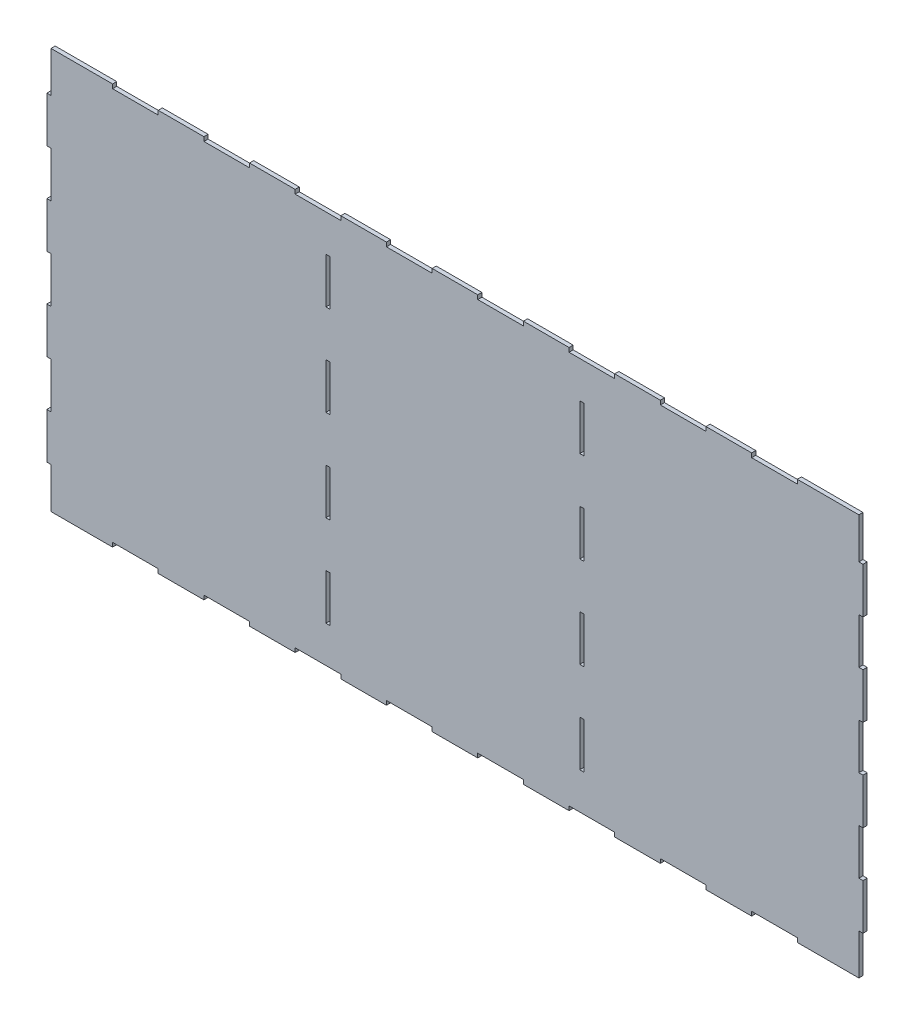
SolidWorks part; units mm, degrees
ref_plane "Front Plane" through (0, 0, 0) normal (0, 0, 1) x (1, 0, 0)
ref_plane "Top Plane" through (0, 0, 0) normal (0, 1, 0) x (1, 0, 0)
ref_plane "Right Plane" through (0, 0, 0) normal (1, 0, 0) x (0, 0, -1)
sketch "Sketch1" plane through (0, 0, 0) normal (0, 0, 1) x (1, 0, 0)
  line L0 (296, 586) -> (296, 556.5)
  line L1 (296, 556.5) -> (293, 556.5)
  line L2 (293, 556.5) -> (293, 523.5)
  line L3 (293, 523.5) -> (296, 523.5)
  line L4 (296, 523.5) -> (296, 490.5)
  line L5 (296, 490.5) -> (293, 490.5)
  line L6 (293, 490.5) -> (293, 457.5)
  line L7 (293, 457.5) -> (296, 457.5)
  line L8 (296, 457.5) -> (296, 424.5)
  line L9 (296, 424.5) -> (293, 424.5)
  line L10 (293, 424.5) -> (293, 391.5)
  line L11 (293, 391.5) -> (296, 391.5)
  line L12 (296, 391.5) -> (296, 358.5)
  line L13 (296, 358.5) -> (293, 358.5)
  line L14 (293, 358.5) -> (293, 325.5)
  line L15 (293, 325.5) -> (296, 325.5)
  line L16 (296, 325.5) -> (296, 296)
  line L17 (296, 296) -> (340.5, 296)
  line L18 (340.5, 296) -> (340.5, 299)
  line L19 (340.5, 299) -> (373.5, 299)
  line L20 (373.5, 299) -> (373.5, 296)
  line L21 (373.5, 296) -> (406.5, 296)
  line L22 (406.5, 296) -> (406.5, 299)
  line L23 (406.5, 299) -> (439.5, 299)
  line L24 (439.5, 299) -> (439.5, 296)
  line L25 (439.5, 296) -> (472.5, 296)
  line L26 (472.5, 296) -> (472.5, 299)
  line L27 (472.5, 299) -> (505.5, 299)
  line L28 (505.5, 299) -> (505.5, 296)
  line L29 (505.5, 296) -> (538.5, 296)
  line L30 (538.5, 296) -> (538.5, 299)
  line L31 (538.5, 299) -> (571.5, 299)
  line L32 (571.5, 299) -> (571.5, 296)
  line L33 (571.5, 296) -> (604.5, 296)
  line L34 (604.5, 296) -> (604.5, 299)
  line L35 (604.5, 299) -> (637.5, 299)
  line L36 (637.5, 299) -> (637.5, 296)
  line L37 (637.5, 296) -> (670.5, 296)
  line L38 (670.5, 296) -> (670.5, 299)
  line L39 (670.5, 299) -> (703.5, 299)
  line L40 (703.5, 299) -> (703.5, 296)
  line L41 (703.5, 296) -> (736.5, 296)
  line L42 (736.5, 296) -> (736.5, 299)
  line L43 (736.5, 299) -> (769.5, 299)
  line L44 (769.5, 299) -> (769.5, 296)
  line L45 (769.5, 296) -> (802.5, 296)
  line L46 (802.5, 296) -> (802.5, 299)
  line L47 (802.5, 299) -> (835.5, 299)
  line L48 (835.5, 299) -> (835.5, 296)
  line L49 (835.5, 296) -> (868.5, 296)
  line L50 (868.5, 296) -> (880, 296)
  line L51 (880, 296) -> (880, 325.5)
  line L52 (880, 325.5) -> (883, 325.5)
  line L53 (883, 325.5) -> (883, 358.5)
  line L54 (883, 358.5) -> (880, 358.5)
  line L55 (880, 358.5) -> (880, 391.5)
  line L56 (880, 391.5) -> (883, 391.5)
  line L57 (883, 391.5) -> (883, 424.5)
  line L58 (883, 424.5) -> (880, 424.5)
  line L59 (880, 424.5) -> (880, 457.5)
  line L60 (880, 457.5) -> (883, 457.5)
  line L61 (883, 457.5) -> (883, 490.5)
  line L62 (883, 490.5) -> (880, 490.5)
  line L63 (880, 490.5) -> (880, 523.5)
  line L64 (880, 523.5) -> (883, 523.5)
  line L65 (883, 523.5) -> (883, 556.5)
  line L66 (883, 556.5) -> (880, 556.5)
  line L67 (880, 556.5) -> (880, 586)
  line L68 (880, 586) -> (835.5, 586)
  line L69 (835.5, 586) -> (835.5, 583)
  line L70 (835.5, 583) -> (802.5, 583)
  line L71 (802.5, 583) -> (802.5, 586)
  line L72 (802.5, 586) -> (769.5, 586)
  line L73 (769.5, 586) -> (769.5, 583)
  line L74 (769.5, 583) -> (736.5, 583)
  line L75 (736.5, 583) -> (736.5, 586)
  line L76 (736.5, 586) -> (703.5, 586)
  line L77 (703.5, 586) -> (703.5, 583)
  line L78 (703.5, 583) -> (670.5, 583)
  line L79 (670.5, 583) -> (670.5, 586)
  line L80 (670.5, 586) -> (637.5, 586)
  line L81 (637.5, 586) -> (637.5, 583)
  line L82 (637.5, 583) -> (604.5, 583)
  line L83 (604.5, 583) -> (604.5, 586)
  line L84 (604.5, 586) -> (571.5, 586)
  line L85 (571.5, 586) -> (571.5, 583)
  line L86 (571.5, 583) -> (538.5, 583)
  line L87 (538.5, 583) -> (538.5, 586)
  line L88 (538.5, 586) -> (505.5, 586)
  line L89 (505.5, 586) -> (505.5, 583)
  line L90 (505.5, 583) -> (472.5, 583)
  line L91 (472.5, 583) -> (472.5, 586)
  line L92 (472.5, 586) -> (439.5, 586)
  line L93 (439.5, 586) -> (439.5, 583)
  line L94 (439.5, 583) -> (406.5, 583)
  line L95 (406.5, 583) -> (406.5, 586)
  line L96 (406.5, 586) -> (373.5, 586)
  line L97 (373.5, 586) -> (373.5, 583)
  line L98 (373.5, 583) -> (340.5, 583)
  line L99 (340.5, 583) -> (340.5, 586)
  line L100 (340.5, 586) -> (307.5, 586)
  line L101 (307.5, 586) -> (296, 586)
  line L102 (494.75, 556.5) -> (497.75, 556.5)
  line L107 (678.25, 556.5) -> (681.25, 556.5)
  line L108 (678.25, 556.5) -> (678.25, 523.5)
  line L109 (678.25, 523.5) -> (681.25, 523.5)
  line L110 (681.25, 556.5) -> (681.25, 523.5)
  line L111 (678.25, 490.5) -> (681.25, 490.5)
  line L112 (678.25, 490.5) -> (678.25, 457.5)
  line L113 (678.25, 457.5) -> (681.25, 457.5)
  line L114 (681.25, 490.5) -> (681.25, 457.5)
  line L115 (678.25, 424.5) -> (681.25, 424.5)
  line L116 (678.25, 424.5) -> (678.25, 391.5)
  line L117 (678.25, 391.5) -> (681.25, 391.5)
  line L118 (681.25, 424.5) -> (681.25, 391.5)
  line L119 (678.25, 358.5) -> (681.25, 358.5)
  line L120 (678.25, 358.5) -> (678.25, 325.5)
  line L121 (678.25, 325.5) -> (681.25, 325.5)
  line L122 (681.25, 358.5) -> (681.25, 325.5)
  line L123 (494.75, 556.5) -> (494.75, 523.5)
  line L124 (494.75, 523.5) -> (497.75, 523.5)
  line L125 (497.75, 556.5) -> (497.75, 523.5)
  line L126 (494.75, 490.5) -> (497.75, 490.5)
  line L127 (494.75, 490.5) -> (494.75, 457.5)
  line L128 (494.75, 457.5) -> (497.75, 457.5)
  line L129 (497.75, 490.5) -> (497.75, 457.5)
  line L130 (494.75, 424.5) -> (497.75, 424.5)
  line L131 (494.75, 424.5) -> (494.75, 391.5)
  line L132 (494.75, 391.5) -> (497.75, 391.5)
  line L133 (497.75, 424.5) -> (497.75, 391.5)
  line L134 (494.75, 358.5) -> (497.75, 358.5)
  line L135 (494.75, 358.5) -> (494.75, 325.5)
  line L136 (494.75, 325.5) -> (497.75, 325.5)
  line L137 (497.75, 358.5) -> (497.75, 325.5)
  dimension "D1" = 293
  dimension "D2" = 296
  dimension "D3" = 307.5
  dimension "D4" = 340.5
  dimension "D5" = 296
  dimension "D6" = 325.5
  dimension "D9" = 33
  dimension "D10" = 33
  dimension "D11" = 33
  dimension "D12" = 33
  dimension "D13" = 33
  dimension "D14" = 33
  dimension "D15" = 33
  dimension "D16" = 26.5
  dimension "D17" = 3
  dimension "D18" = 3
  dimension "D19" = 3
  dimension "D20" = 3
  dimension "D21" = 198.75
  dimension "D22" = 198.75
  dimension "D23" = 198.75
  dimension "D24" = 198.75
  dimension "D25" = 33
  dimension "D26" = 33
  dimension "D27" = 33
  dimension "D28" = 33
  dimension "D29" = 33
  dimension "D30" = 33
  dimension "D31" = 33
  dimension "D32" = 3
  dimension "D33" = 3
  dimension "D34" = 3
  dimension "D35" = 3
  dimension "D36" = 198.75
  dimension "D37" = 198.75
  dimension "D38" = 198.75
  dimension "D39" = 198.75
  dimension "D40" = 26.5
extrude "Boss-Extrude1" add sketch "Sketch1" along normal blind 3
